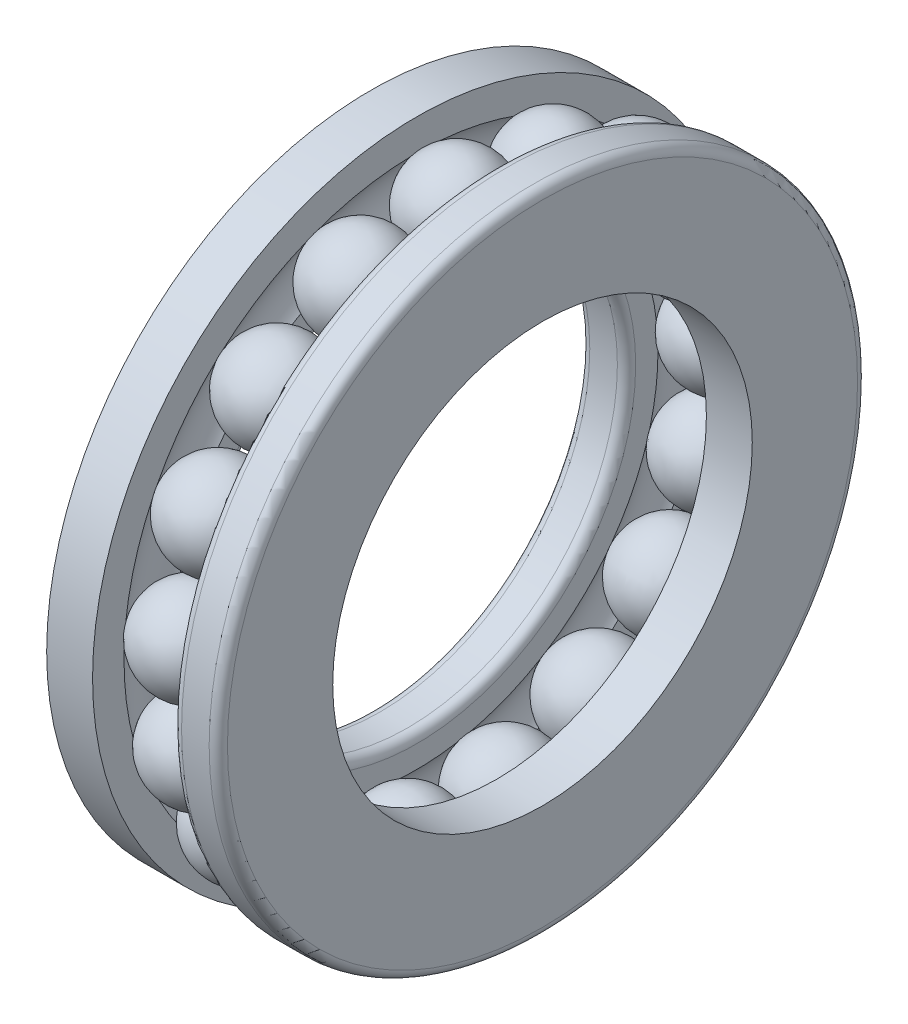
SolidWorks part; units mm, degrees
ref_plane "Plane1" through (0, 0, 0) normal (0, 0, 1) x (1, 0, 0)
ref_plane "Plane2" through (0, 0, 0) normal (0, 1, 0) x (1, 0, 0)
ref_plane "Plane3" through (0, 0, 0) normal (1, 0, 0) x (0, 0, -1)
sketch "Clipboard" plane through (0, 0, 0) normal (0, 0, 1) x (1, 0, 0)
  line L0 (-10, 0) -> (10, 0) construction
  line L1 (0, 0) -> (21.3836, -6.5376)
  line L2 (0, 0) -> (27.3662, 35.0271)
  line L3 (0, 0) -> (13.7666, -17.6205)
  line L4 (0, 0) -> (-22.3471, -0.7804)
  dimension "BallCLRad" = 44.45
  dimension "Count" = 52
  dimension "Show_count" = 52
  dimension "Max_count" = 17
  dimension "Min_count" = 2
sketch "InnRacSke" plane through (0, 0, 0) normal (0, 0, 1) x (1, 0, 0)
  line L0 (-6.6469, 40.1581) -> (-6.6469, 34.925)
  line L1 (-6.6469, 34.925) -> (-14.2875, 34.925)
  line L2 (-14.2875, 34.925) -> (-14.2875, 53.975)
  line L3 (-14.2875, 53.975) -> (-6.6469, 53.975)
  line L4 (-6.6469, 53.975) -> (-6.6469, 48.7419)
  line L5 (-34.9219, 0) -> (34.9219, 0) construction
  line L6 (0, 0) -> (0, 25.4) construction
  arc A2 (-6.6469, 48.7419) -> (-6.6469, 40.1581) centre (0, 44.45) ccw
  dimension "Ball_diameter" = 15.8242
  dimension "ID" = 69.85
  dimension "OD" = 107.95
  dimension "Width" = 28.575
  dimension "gap" = 13.2937
  dimension "BallCLRad" = 44.45
revolve "Race" add sketch "InnRacSke" angle 360 about L5
ref_axis "Axis1" through (-50, 0, 0) along (1, 0, 0)
sketch "BalDetSke" plane through (0, 0, 0) normal (0, 0, 1) x (1, 0, 0)
  line L0 (-7.9375, 44.45) -> (7.9375, 44.45)
  line L1 (-14.5732, 44.45) -> (14.5732, 44.45) construction
  arc A0 (7.9375, 44.45) -> (-7.9375, 44.45) centre (0, 44.45) cw
  dimension "Ball_diameter" = 15.875
  dimension "BallCLRad" = 44.45
revolve "BallDetailed" add sketch "BalDetSke" angle 360 about L1
sketch "BalSimSke" plane through (0, 0, 0) normal (0, 0, 1) x (1, 0, 0)
  line L0 (-25.4, 0) -> (25.4, 0) construction
  circle A0 centre (0, 44.45) radius 7.9375
  dimension "Ball_diameter" = 15.875
  dimension "BallCLRad" = 44.45
revolve "BallsSimplified" [suppressed] add sketch "BalSimSke" angle 360 about L0
mirror "Mirror1" about plane through (0, 0, 0) normal (1, 0, 0) of "Race"
fillet "Fillet" radius 1.524 4 edges at (6.6469, 0, -53.975) (14.2875, 0, -53.975) (-6.6469, 0, -34.925) (-14.2875, 0, -34.925)
pattern_circular "BallsDetailed" count 17 every 21.176 about axis through (-50, 0, 0) along (1, 0, 0) of "BallDetailed"
sketch "CagSpiSke" plane through (0, 0, 0) normal (0, 0, 1) x (1, 0, 0)
  line L0 (1.9844, 35.7188) -> (1.9844, 53.1812)
  line L1 (1.9844, 53.1812) -> (-1.9844, 53.1812)
  line L2 (-1.9844, 35.7188) -> (-1.9844, 53.1812)
  line L3 (-1.9844, 35.7188) -> (1.9844, 35.7188)
  line L4 (-34.925, 0) -> (34.925, 0) construction
  line L5 (0, 0) -> (0, 76.2) construction
  dimension "Thickness" = 3.9687
  dimension "ID" = 71.4375
  dimension "OD" = 106.3625
revolve "CageSpine" [suppressed] add sketch "CagSpiSke" angle 360 about L4
equation "\"BallCLRad@Clipboard\" =  ( \"OD@InnRacSke\" + \"ID@InnRacSke\" )  / 4"
equation "\"BallCLRad@BalSimSke\" = \"BallCLRad@Clipboard\""
equation "\"BallCLRad@BalDetSke\" = \"BallCLRad@Clipboard\""
equation "\"BallCLRad@InnRacSke\" = \"BallCLRad@Clipboard\""
equation "\"Ball_diameter@InnRacSke\" = \"Ball_diameter@BalDetSke\" - 0.002"
equation "\"Ball_diameter@BalSimSke\" = \"Ball_diameter@BalDetSke\""
equation "\"Max_count@Clipboard\" = int( 3.14159265 / atn(( \"Ball_diameter@BalDetSke\" / 2) / sqr( \"BallCLRad@Clipboard\"  *  \"BallCLRad@Clipboard\" - ( \"Ball_diameter@BalDetSke\" / 2) *  ( \"Ball_diameter@BalDetSke\" "
equation "\"Max_count@Clipboard\" = ((sgn( \"Max_count@Clipboard\" - \"Count@Clipboard\" )-1)*( \"Max_count@Clipboard\" - \"Count@Clipboard\" ))/-2+ \"Count@Clipboard\""
equation "\"Count@BallsDetailed\" = int( \"Show_count@Clipboard\" ) "
equation "\"Count@BallsDetailed\" = ((sgn( \"Count@BallsDetailed\" - \"Max_count@Clipboard\" )-1)*( \"Count@BallsDetailed\" - \"Max_count@Clipboard\" ))/-2+ \"Max_count@Clipboard\""
equation "\"Count@BallsDetailed\" = ((sgn( \"Count@BallsDetailed\" - \"Min_count@Clipboard\" )+1)*( \"Count@BallsDetailed\" - \"Min_count@Clipboard\"))/2 +\"Min_count@Clipboard\""
equation "\"Angle@BallsDetailed\" = 360.0 / \"Max_count@Clipboard\""
equation "\"Angle@CageSpine\" =  \"Angle@BallsDetailed\" * ( \"Count@BallsDetailed\" -1 + int( \"Count@BallsDetailed\" / \"Max_count@Clipboard\" ) )  + 0.001 -  int( \"Count@BallsDetailed\" / \"Max_count@Clipboard\" ) * 0.00"
equation "\"Angle@CageSpine\" =  \"Angle@CageSpine\" * int( \"Min_count@Clipboard\" / 2) + int(1 / \"Min_count@Clipboard\")  * 0.001"
equation "\"Thickness@CagSpiSke\" =  \"Ball_diameter@BalDetSke\" * 0.25"
equation "\"OD@CagSpiSke\" = ( \"OD@InnRacSke\" + ( \"BallCLRad@Clipboard\" * 2 + \"Ball_diameter@BalDetSke\" )) / 2"
equation "\"ID@CagSpiSke\" = ( \"ID@InnRacSke\" + ( \"BallCLRad@Clipboard\" * 2 - \"Ball_diameter@BalDetSke\" )) / 2"
